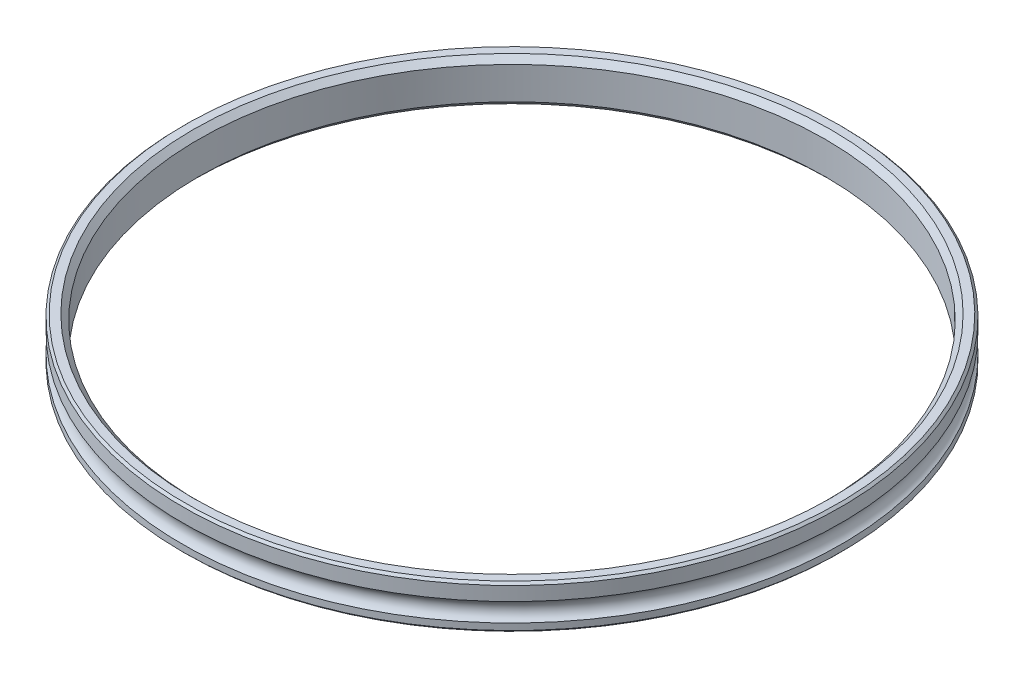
SolidWorks part; units mm, degrees
ref_plane "Front" through (0, 0, 0) normal (0, 0, 1) x (1, 0, 0)
ref_plane "Top" through (0, 0, 0) normal (0, 1, 0) x (1, 0, 0)
ref_plane "Right" through (0, 0, 0) normal (1, 0, 0) x (0, 0, -1)
sketch "Sketch1" plane through (0, 0, 0) normal (0, 0, 1) x (1, 0, 0)
  line L0 (0, 0) -> (0, 23.351) construction
  line L1 (0, 0) -> (-43.8593, 0) construction
  line L3 (-57.15, -3.2944) -> (-60.0837, -3.2944)
  line L4 (-57.15, -3.2944) -> (-57.15, 4.6431)
  line L5 (-57.15, 4.6431) -> (-60.0837, 4.6431)
  line L6 (-60.0837, -3.2944) -> (-60.0837, 4.6431)
  dimension "D1" = 4.6431
  dimension "D3" = 3.2944
  dimension "D4" = 7.9375
  dimension "BORE" = 114.3
  dimension "LAND DIA L1" = 120.1674
revolve "Base-Revolve" add sketch "Sketch1" angle 360 about L0
sketch "Sketch2" plane through (0, 0, 0) normal (0, 0, 1) x (1, 0, 0)
  line L0 (0, 0) -> (0, 6.1529) construction
  line L1 (0, 0) -> (0, 23.351) construction
  line L2 (0, 0) -> (-30.9737, 0) construction
  line L3 (-60.0837, -1.6923) -> (-60.0837, 1.6923)
  arc A0 (-60.0837, -1.6923) -> (-60.0837, 1.6923) centre (-61.1187, 0) ccw
  dimension "PATH RAD" = 1.9837
  dimension "O.D. OF PATH" = 120.1674
  dimension "PITCH DIA" = 122.2375
revolve "Cut-Revolve Path" cut sketch "Sketch2" angle 360 about L0
chamfer "Chamfer I.D. Edge" distance 1.016 angle 45 2 edges at (0, -3.2944, -57.15) (0, 4.6431, -57.15)
chamfer "Chamfer Seal Seat" distance 0.4127 angle 45 2 edges at (0, -3.2944, -60.0837) (0, 4.6431, -60.0837)
